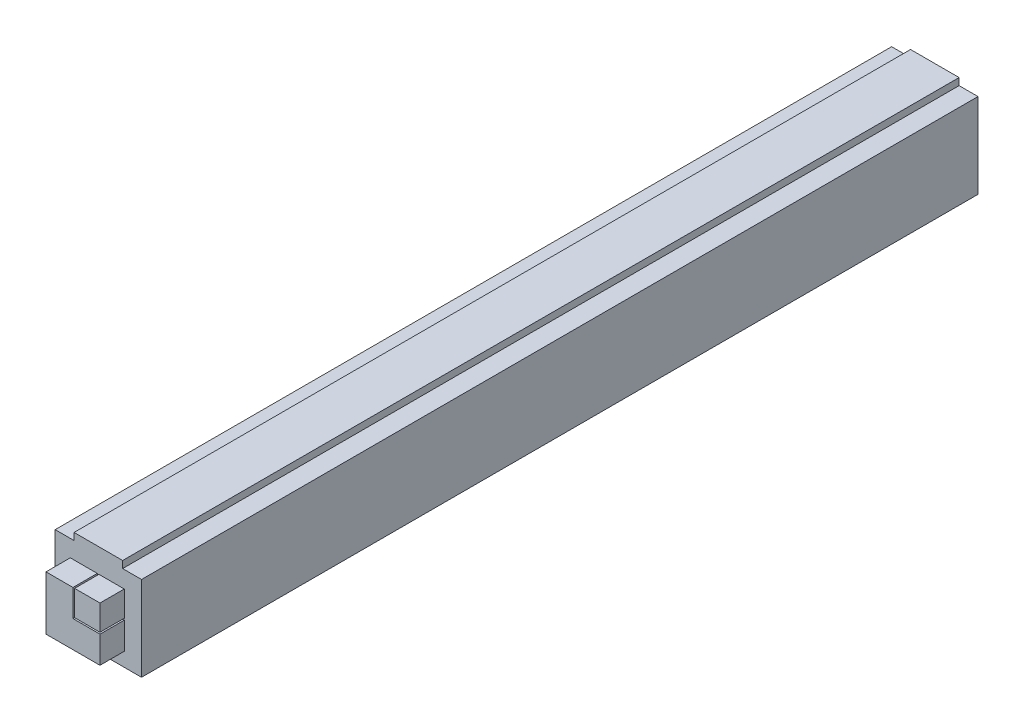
SolidWorks part; units mm, degrees
ref_plane "Płaszczyzna przednia" through (0, 0, 0) normal (0, 0, 1) x (1, 0, 0)
ref_plane "Płaszczyzna górna" through (0, 0, 0) normal (0, 1, 0) x (1, 0, 0)
ref_plane "Płaszczyzna prawa" through (0, 0, 0) normal (1, 0, 0) x (0, 0, -1)
sketch "Szkic2" plane through (0, 0, 0) normal (0, 0, 1) x (1, 0, 0)
  line L0 (4.5, 29.7607) -> (4.5, 28.4607)
  line L1 (-4.5, 29.7607) -> (4.5, 29.7607)
  line L2 (-8, 28.4607) -> (-8, 12.7607)
  line L3 (-8, 12.7607) -> (8, 12.7607)
  line L4 (8, 28.4607) -> (8, 12.7607)
  line L5 (-6.7765, 28.4607) -> (8, 12.7607) construction
  line L6 (-8, 12.7607) -> (6.7765, 28.4607) construction
  line L7 (4.5, 28.4607) -> (8, 28.4607)
  line L8 (0, 31.2078) -> (0, 10.088) construction
  line L9 (-4.5, 28.4607) -> (-8, 28.4607)
  line L10 (-4.5, 29.7607) -> (-4.5, 28.4607)
  point P0 (0, 21.2607)
  dimension "D3" = 1.3
  dimension "D4" = 3.5
extrude "Dodanie-wyciągnięcie2" add sketch "Szkic2" against normal blind 155 from offset 5 separate body
sketch "Szkic3" plane through (0, 0, -5) normal (0, 0, 1) x (1, 0, 0)
  line L0 (0, 25.5354) -> (0, 20.5354)
  line L1 (-5, 25.5354) -> (0, 25.5354)
  line L2 (-5, 25.5354) -> (-5, 15.5354)
  line L3 (-5, 15.5354) -> (5, 15.5354)
  line L4 (5, 25.5354) -> (5, 20.8368)
  line L5 (-5, 25.5354) -> (5, 15.5354) construction
  line L6 (-5, 15.5354) -> (5, 25.5354) construction
  line L7 (0, 20.5354) -> (5, 20.5354)
  line L8 (0.3014, 25.5354) -> (0.3014, 20.8368)
  line L9 (0.3014, 20.8368) -> (5, 20.8368)
  line L10 (0.3014, 25.5354) -> (5, 25.5354)
  line L11 (5, 20.5354) -> (5, 15.5354)
  point P0 (0, 20.5354)
  dimension "D1" = 10
  dimension "D2" = 10
extrude "Dodanie-wyciągnięcie3" add sketch "Szkic3" along normal blind 4.5 from offset 0.2 separate body
sketch "Szkic4" plane through (0, 12.7607, 0) normal (0, -1, 0) x (1, 0, 0)
  line L0 (-8, -160) -> (8, -160) construction
  circle A0 centre (0, -82.4) radius 6.65
  dimension "D1" = 13.3
  dimension "D2" = 77.6
extrude "Wytnij-wyciągnięcie1" cut sketch "Szkic4" against normal blind 5
